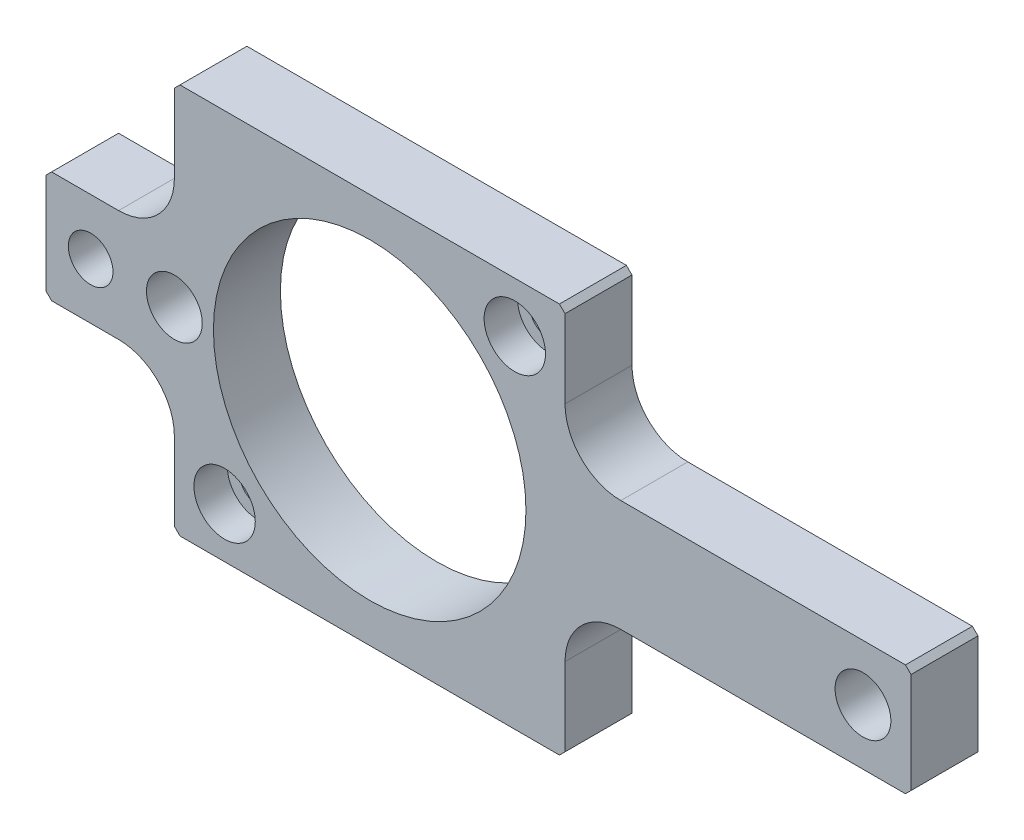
SolidWorks part; units mm, degrees
ref_plane "Plan1" through (0, 0, 0) normal (0, 0, 1) x (1, 0, 0)
ref_plane "Plan2" through (0, 0, 0) normal (0, 1, 0) x (1, 0, 0)
ref_plane "Plan3" through (0, 0, 0) normal (1, 0, 0) x (0, 0, -1)
sketch "Esquisse4" plane through (0, 0, 0) normal (0, 0, 1) x (1, 0, 0)
  line L0 (0, 0) -> (70, 0)
  line L1 (70, 0) -> (70, 15)
  line L2 (80, 25) -> (132, 25)
  line L3 (132, 25) -> (132, 45)
  line L4 (132, 45) -> (80, 45)
  line L5 (70, 55) -> (70, 70)
  line L6 (70, 70) -> (0, 70)
  line L7 (0, 70) -> (0, 55)
  line L8 (-10, 45) -> (-23, 45)
  line L9 (-23, 45) -> (-23, 25)
  line L10 (-23, 25) -> (-10, 25)
  line L11 (0, 15) -> (0, 0)
  arc A0 (70, 55) -> (80, 45) centre (80, 55) ccw
  arc A1 (70, 15) -> (80, 25) centre (80, 15) cw
  arc A2 (0, 15) -> (-10, 25) centre (-10, 15) ccw
  arc A3 (0, 55) -> (-10, 45) centre (-10, 55) cw
  circle A4 centre (35, 35) radius 28
  point P15 (70, 45)
  point P18 (70, 25)
  point P21 (0, 25)
  point P24 (0, 45)
  dimension "D12" = 10
  dimension "D13" = 56
  dimension "D1" = 70
  dimension "D2" = 62
  dimension "D3" = 20
  dimension "D4" = 25
  dimension "D5" = 23
  dimension "D6" = 20
  dimension "D7" = 25
  dimension "D8" = 25
  dimension "D9" = 25
  dimension "D10" = 23
  dimension "D11" = 62
  dimension "D18" = 35
  dimension "D19" = 35
extrude "Base-Extrusion" add sketch "Esquisse4" along normal blind 12
chamfer "Chanfrein2" distance 1 angle 45
hole_wizard "Perçage1" positions "Esquisse6" profile "Esquisse5" counterbore size "M6" standard "ISO"
sketch "Esquisse6" plane through (0, 0, 12) normal (0, 0, 1) x (1, 0, 0)
  circle A0 centre (35, 35) radius 28 construction
  point P0 (9, 9)
  point P1 (61, 61)
  dimension "D1" = 26
  dimension "D2" = 26
  dimension "D3" = 26
  dimension "D4" = 26
sketch "Esquisse5" plane through (9, 9, 12) normal (1, 0, 0) x (0, -1, 0)
  line L0 (0, 0) -> (0, 12)
  line L1 (0, 12) -> (3.3, 12)
  line L3 (3.3, 12) -> (3.3, 6)
  line L4 (3.3, 6) -> (5.5, 6)
  line L5 (5.5, 6) -> (5.5, 0)
  line L7 (5.5, 0) -> (0, 0)
  line L11 (0, -6.35) -> (0, 107.95) construction
  dimension "Diamètre du perçage jusqu'au prochain" = 6.6
  dimension "Profondeur du perçage jusqu'au prochain" = 12
  dimension "Diamètre du chambrage" = 11
  dimension "Profondeur du chambrage" = 6
sketch "Esquisse7" plane through (0, 0, 12) normal (0, 0, 1) x (1, 0, 0)
  circle A0 centre (0, 35) radius 5
  circle A1 centre (-15, 35) radius 4
  circle A2 centre (123.39, 35) radius 5
  circle A3 centre (35, 35) radius 28 construction
  dimension "D1" = 10
  dimension "D2" = 10
  dimension "D3" = 8
  dimension "D4" = 88.39
  dimension "D5" = 35
  dimension "D6" = 50
extrude "Enlèv. mat.-Extru.1" cut sketch "Esquisse7" against normal through all
